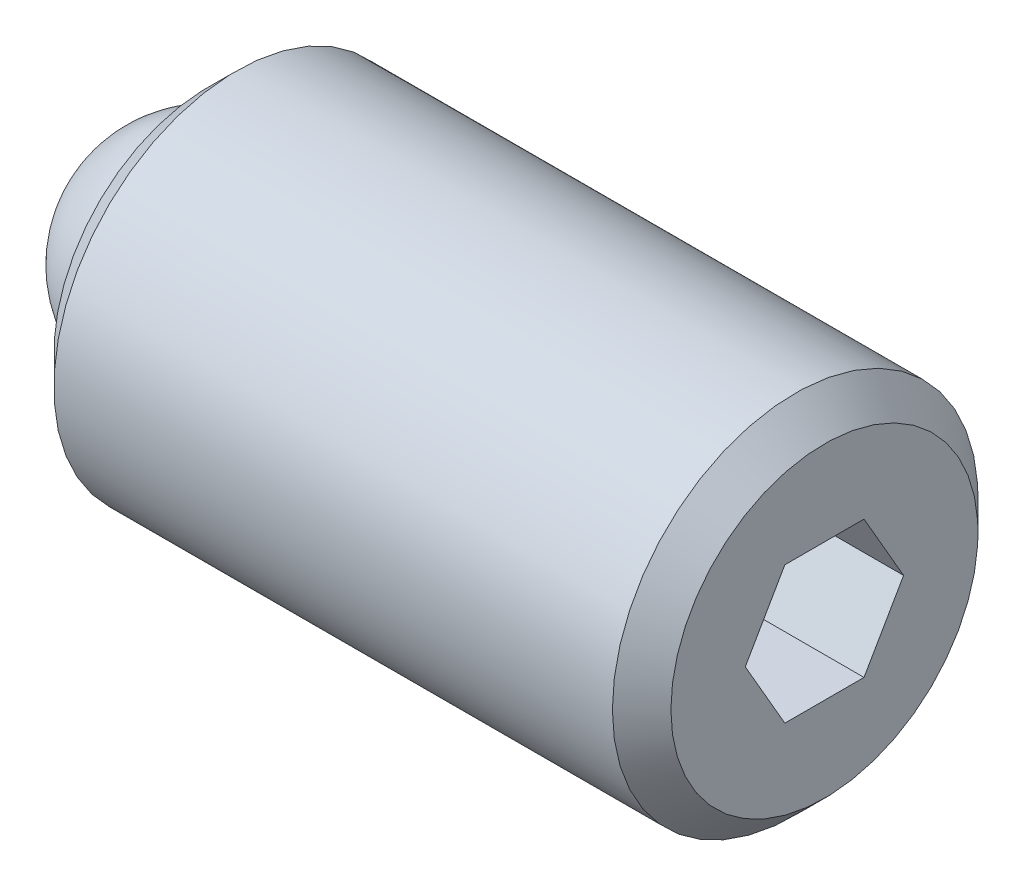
SolidWorks part; units mm, degrees
ref_plane "Front Plane" through (0, 0, 0) normal (0, 0, 1) x (1, 0, 0)
ref_plane "Top Plane" through (0, 0, 0) normal (0, 1, 0) x (1, 0, 0)
ref_plane "Right Plane" through (0, 0, 0) normal (1, 0, 0) x (0, 0, -1)
sketch "Sketch2" plane through (0, 0, 0) normal (1, 0, 0) x (0, 0, -1)
  circle A0 centre (0, 0) radius 3.175
  dimension "D1" = 6.35
extrude "Boss-Extrude1" add sketch "Sketch2" along normal blind 10.7156
sketch "Sketch3" plane through (0, 0, 0) normal (-1, 0, 0) x (0, 0, 1)
  circle A0 centre (0, 0) radius 1.9812
  dimension "D1" = 3.9624
chamfer "Chamfer1" distance 0.508 angle 45 1 edges at (0, 0, -3.175)
chamfer "Chamfer2" distance 0.508 angle 45 1 edges at (10.7156, 0, -3.175)
sketch "Sketch4" plane through (10.7156, 0, 0) normal (1, 0, 0) x (0, 0, -1)
  line L1 (1.3748, 0) -> (0.6874, 1.1906)
  line L2 (0.6874, 1.1906) -> (-0.6874, 1.1906)
  line L3 (-0.6874, 1.1906) -> (-1.3748, 0)
  line L4 (-1.3748, 0) -> (-0.6874, -1.1906)
  line L5 (-0.6874, -1.1906) -> (0.6874, -1.1906)
  line L6 (0.6874, -1.1906) -> (1.3748, 0)
  circle A0 centre (0, 0) radius 1.1906 construction
  dimension "D1" = 2.3813
extrude "Cut-Extrude2" cut sketch "Sketch4" against normal blind 2.286
extrude "Cut-Extrude3" cut sketch "Sketch3" against normal blind 1.9844
sketch "Sketch5" plane through (0, 0, 0) normal (-1, 0, 0) x (0, 0, 1)
  line L0 (0, 0) -> (0, -1.9844)
  line L1 (0, 0) -> (0, 1.9844)
  arc A0 (0, 1.9844) -> (0, -1.9844) centre (0, 0) ccw
  dimension "D1" = 1.9844
revolve "Revolve1" add sketch "Sketch5" angle 360 about L1
sketch "Sketch6" plane through (0, 0, 0) normal (-1, 0, 0) x (0, 0, 1)
  line L0 (0, 0) -> (0, 1.9812) construction
  circle A0 centre (0, 0) radius 1.9812 construction
  arc A1 (0.0635, 1.9802) -> (-0.0635, 1.9802) centre (0, 0) ccw
  arc A2 (0.0635, 1.9802) -> (-0.0635, 1.9802) centre (0, 1.9812) ccw
  dimension "D1" = 0.127
extrude "Cut-Extrude4" cut sketch "Sketch6" against normal up to surface (1.9844 mm away) contours A2 A1
